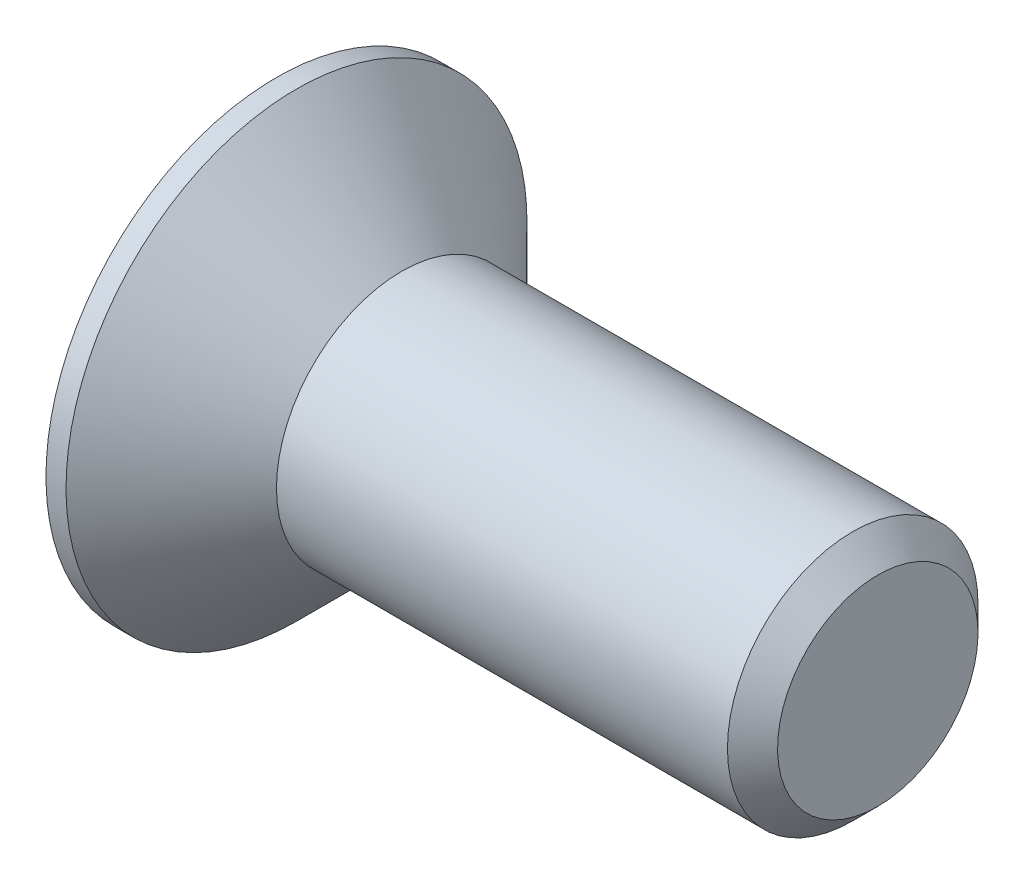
SolidWorks part; units mm, degrees
ref_plane "Front Plane" through (0, 0, 0) normal (0, 0, 1) x (1, 0, 0)
ref_plane "Top Plane" through (0, 0, 0) normal (0, 1, 0) x (1, 0, 0)
ref_plane "Right Plane" through (0, 0, 0) normal (1, 0, 0) x (0, 0, -1)
sketch "Sketch1" plane through (0, 0, 0) normal (0, 0, 1) x (1, 0, 0)
  line L1 (-2.5, 4.6) -> (-2.5, 0)
  line L2 (-2.5, 0) -> (9.5, 0)
  line L3 (9.5, 0) -> (9.5, 2.5)
  line L4 (9.5, 2.5) -> (0, 2.5)
  line L5 (-2.5, 4.6) -> (-2.1, 4.6)
  line L6 (-2.1, 4.6) -> (0, 2.5)
  dimension "D1" = 2.5
  dimension "D2" = 45
  dimension "D3" = 2.5
  dimension "D4" = 12
  dimension "D5" = 4.6
revolve "Revolve1" add sketch "Sketch1" angle 360 about L2
chamfer "Chamfer1" distance 0.5 angle 45 1 edges at (9.5, -2.5, 0)
sketch "Sketch2" plane through (-2.5, 0, 0) normal (-1, 0, 0) x (0, 0, 1)
  line L0 (-0.575, 2.3) -> (0.575, 2.3)
  line L1 (0.575, 2.3) -> (0.575, 0.575)
  line L2 (0.575, 0.575) -> (2.3, 0.575)
  line L3 (2.3, 0.575) -> (2.3, -0.575)
  line L4 (2.3, -0.575) -> (0.575, -0.575)
  line L5 (0.575, -0.575) -> (0.575, -2.3)
  line L6 (0.575, -2.3) -> (-0.575, -2.3)
  line L7 (-0.575, -2.3) -> (-0.575, -0.575)
  line L8 (-0.575, -0.575) -> (-2.3, -0.575)
  line L9 (-2.3, -0.575) -> (-2.3, 0.575)
  line L10 (-2.3, 0.575) -> (-0.575, 0.575)
  line L11 (-0.575, 0.575) -> (-0.575, 2.3)
  point P2 (0, 2.3)
  point P14 (0, -2.3)
  point P15 (2.3, 0)
  point P16 (-2.3, 0)
  dimension "D1" = 4.6
  dimension "D2" = 1.15
extrude "Cut-Extrude1" cut sketch "Sketch2" against normal blind 2.1
